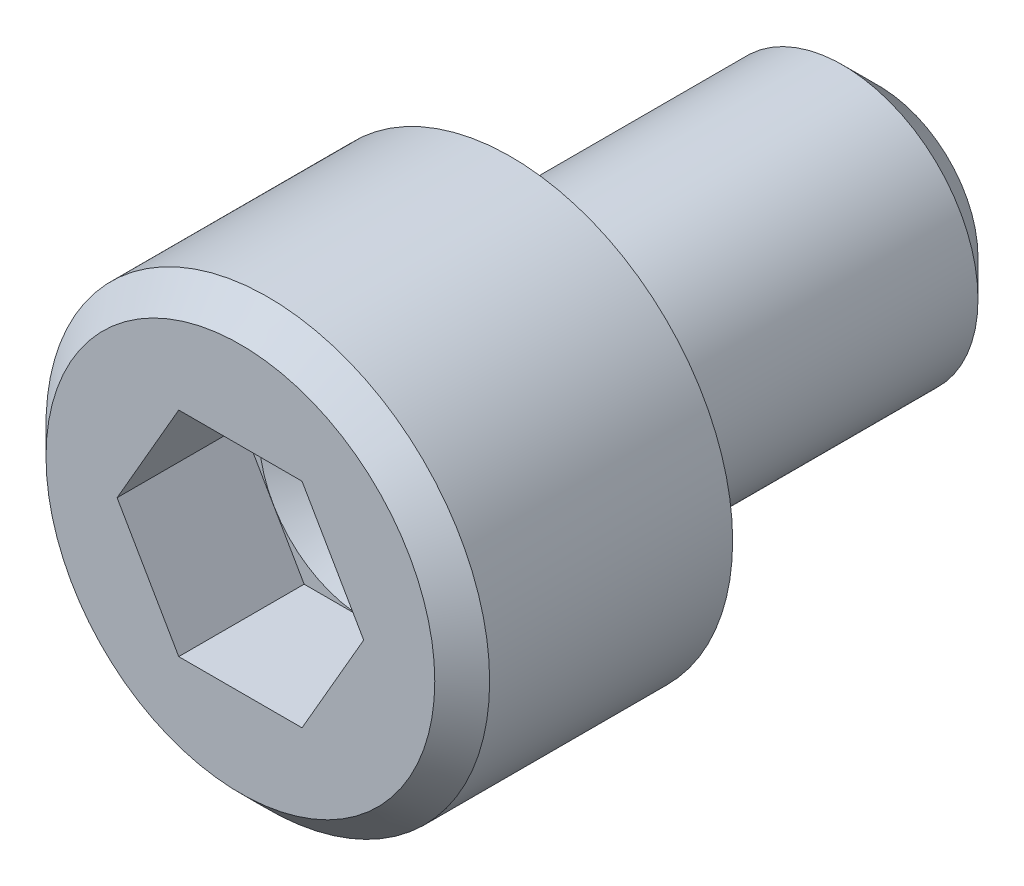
SolidWorks part; units mm, degrees
ref_plane "Front Plane" through (0, 0, 0) normal (0, 0, 1) x (1, 0, 0)
ref_plane "Top Plane" through (0, 0, 0) normal (0, 1, 0) x (1, 0, 0)
ref_plane "Right Plane" through (0, 0, 0) normal (1, 0, 0) x (0, 0, -1)
sketch "Sketch1" plane through (0, 0, 0) normal (1, 0, 0) x (0, 0, -1)
  line L0 (0, 0) -> (8.2804, 0) construction
  line L1 (0, 0) -> (8.2804, 0)
  line L2 (8.2804, 0) -> (8.2804, 1.2802)
  line L3 (8.2804, 1.2802) -> (7.808, 1.7526)
  line L4 (7.808, 1.7526) -> (3.5052, 1.7526)
  line L5 (3.5052, 1.7526) -> (3.5052, 2.8752)
  line L6 (3.5052, 2.8752) -> (0.3556, 2.8752)
  line L7 (0.3556, 2.8752) -> (0, 2.5196)
  line L8 (0, 2.5196) -> (0, 0)
  dimension "D1" = 45
  dimension "D2" = 2.5603
  dimension "D3" = 3.5052
  dimension "D4" = 45
  dimension "D5" = 5.7504
  dimension "D6" = 3.1496
  dimension "D7" = 3.5052
  dimension "D8" = 4.7752
revolve "Revolve1" add sketch "Sketch1" angle 360 about L0
fillet "Fillet1" radius 0.254 1 edges at (1.7526, 0, -3.5052)
sketch "Sketch2" plane through (0, 0, 0) normal (1, 0, 0) x (0, 0, -1)
  line L0 (0, 0) -> (2.4243, 0) construction
  line L1 (0, 2.5196) -> (0, -2.5196) construction
  line L2 (2.4243, 0) -> (1.6252, 1.384)
  line L3 (1.6252, 1.384) -> (0, 1.384)
  line L4 (0, 1.384) -> (0, 0)
  line L5 (0, 0) -> (2.4243, 0)
  line L6 (3.5052, -2.8752) -> (3.5052, 2.8752) construction
  dimension "D1" = 60
  dimension "D2" = 1.88
  dimension "D3" = 1.384
revolve "Cut-Revolve1" cut sketch "Sketch2" angle 360 about L0
sketch "Sketch3" plane through (0, 0, 0) normal (0, 0, 1) x (1, 0, 0)
  line L1 (0.7991, 1.384) -> (-0.7991, 1.384)
  line L2 (-0.7991, 1.384) -> (-1.5981, 0)
  line L3 (-1.5981, 0) -> (-0.7991, -1.384)
  line L4 (-0.7991, -1.384) -> (0.7991, -1.384)
  line L5 (0.7991, -1.384) -> (1.5981, 0)
  line L6 (1.5981, 0) -> (0.7991, 1.384)
  circle A0 centre (0, 0) radius 1.384 construction
  circle A1 centre (0, 0) radius 1.384 construction
extrude "Cut-Extrude1" cut sketch "Sketch3" against normal blind 1.6256
